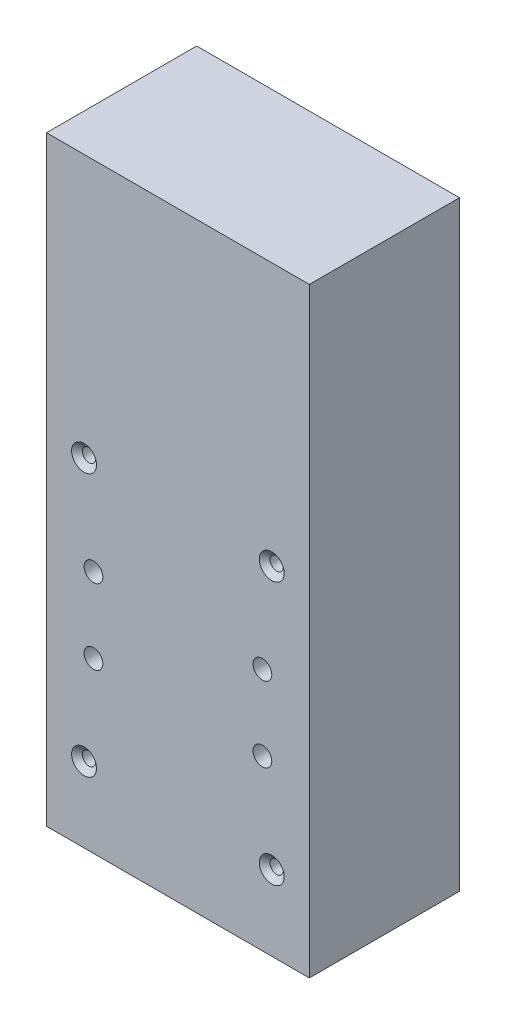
SolidWorks part; units mm, degrees
ref_plane "Front Plane" through (0, 0, 0) normal (0, 0, 1) x (1, 0, 0)
ref_plane "Top Plane" through (0, 0, 0) normal (0, 1, 0) x (1, 0, 0)
ref_plane "Right Plane" through (0, 0, 0) normal (1, 0, 0) x (0, 0, -1)
sketch "Sketch1" plane through (0, 0, 0) normal (0, 1, 0) x (1, 0, 0)
  line L1 (-44.45, 25.4) -> (44.45, 25.4)
  line L2 (-44.45, 25.4) -> (-44.45, -25.4)
  line L3 (-44.45, -25.4) -> (44.45, -25.4)
  line L4 (44.45, 25.4) -> (44.45, -25.4)
  line L5 (-44.45, 25.4) -> (44.45, -25.4) construction
  line L6 (-44.45, -25.4) -> (44.45, 25.4) construction
  point P0 (0, 0)
  dimension "D1" = 88.9
  dimension "D2" = 50.8
extrude "Boss-Extrude1" add sketch "Sketch1" along normal blind 203.2
hole_wizard "CSK for #8 Flat Head Machine Screw (100)1" positions "Sketch3" profile "Sketch2" countersink size "#8" standard "ANSI Inch"
sketch "Sketch3"
  line L0 (-44.45, 0) -> (44.45, 0) construction
  line L1 (44.45, 203.2) -> (44.45, 0) construction
  line L2 (-44.45, 203.2) -> (-44.45, 0) construction
  point P0 (-31.75, 25.4)
  point P2 (31.75, 25.4)
  point P4 (-31.75, 114.3)
  point P6 (31.75, 114.3)
  dimension "D1" = 25.4
  dimension "D2" = 25.4
  dimension "D3" = 114.3
  dimension "D4" = 114.3
  dimension "D5" = 12.7
  dimension "D6" = 12.7
  dimension "D7" = 12.7
  dimension "D8" = 12.7
sketch "Sketch2" plane through (-31.75, 25.4, 25.4) normal (1, 0, 0) x (0, -1, 0)
  line L0 (0, 0) -> (0, 50.8)
  line L1 (0, 50.8) -> (2.2479, 50.8)
  line L2 (2.2479, 50.8) -> (2.2479, 1.6518)
  line L3 (2.2479, 1.6518) -> (4.2164, 0)
  line L5 (4.2164, 0) -> (0, 0)
  line L6 (-2.2479, 1.6518) -> (-4.2164, 0) construction
  line L11 (0, -6.35) -> (0, 107.95) construction
  dimension "Thru Hole Dia." = 4.4958
  dimension "Thru Hole Depth" = 50.8
  dimension "Near C'Sink Dia." = 8.4328
  dimension "Near C'Sink Angle" = 100
hole_wizard "1/4 (0.25) Diameter Hole1" positions "Sketch4" profile "Sketch5" hole size "1/4" standard "ANSI Inch"
sketch "Sketch4" plane through (-1873.5979, -1046.7572, 25.4) normal (0, 0, 1) x (1, 0, 0)
  point P0 (1834.9862, 1129.2666)
  point P3 (1834.9862, 1103.8666)
  point P6 (1892.1362, 1103.8666)
  point P9 (1892.1362, 1129.2666)
  point P12 (2368.3862, 1129.2666)
  point P15 (2368.3862, 1103.8666)
  point P18 (2311.2362, 1129.2666)
  point P21 (2311.2362, 1103.8666)
  point P24 (3327.7479, 1142.0072)
  point P27 (3327.7479, 1116.6072)
  point P30 (3384.8979, 1116.6072)
  point P33 (3384.8979, 1142.0072)
  point P36 (3790.7862, 1103.9072)
  point P39 (3790.7862, 1129.3072)
  point P42 (3847.9362, 1129.3072)
  point P45 (3847.9362, 1103.9072)
sketch "Sketch5" plane through (-28.8309, 82.5094, 25.4) normal (1, 0, 0) x (0, -1, 0)
  line L0 (0, 0) -> (0, 103.5067)
  line L1 (0, 103.5067) -> (3.175, 101.599)
  line L2 (3.175, 101.599) -> (3.175, 0)
  line L3 (3.175, 0) -> (0, 0)
  line L4 (0, 103.5067) -> (-3.175, 101.599) construction
  line L5 (0, -6.35) -> (0, 107.95) construction
  dimension "Hole Dia." = 6.35
  dimension "Hole Depth" = 101.599
  dimension "Drill Angle" = 118
sketch "Sketch8" plane through (0, 69.8094, 25.4) normal (0, 0, -1) x (1, 0, 0)
  line L0 (-38.1, 22.225) -> (38.1, -22.225) construction
  line L1 (-34.1376, 22.225) -> (34.1376, 22.225)
  line L2 (-38.1, 18.2626) -> (-38.1, -18.2626)
  line L3 (-34.1376, -22.225) -> (34.1376, -22.225)
  line L4 (38.1, 18.2626) -> (38.1, -18.2626)
  line L5 (-44.45, -133.3906) -> (-44.45, 69.8094) construction
  line L8 (0, 0) -> (0, 22.225) construction
  line L9 (0, 0) -> (38.1, 0) construction
  circle A0 centre (-28.575, 12.7) radius 3.175
  circle A1 centre (-28.575, -12.7) radius 3.175
  circle A2 centre (28.575, -12.7) radius 3.175
  circle A3 centre (28.575, 12.7) radius 3.175
  arc A4 (-38.1, -18.2626) -> (-34.1376, -22.225) centre (-34.1376, -18.2626) ccw
  arc A5 (34.1376, -22.225) -> (38.1, -18.2626) centre (34.1376, -18.2626) ccw
  arc A6 (34.1376, 22.225) -> (38.1, 18.2626) centre (34.1376, 18.2626) cw
  arc A7 (-34.1376, 22.225) -> (-38.1, 18.2626) centre (-34.1376, 18.2626) ccw
  point P24 (38.1, 22.225)
  dimension "D1" = 6.35
extrude "Cut-Extrude1" cut sketch "Sketch8" along normal through all
